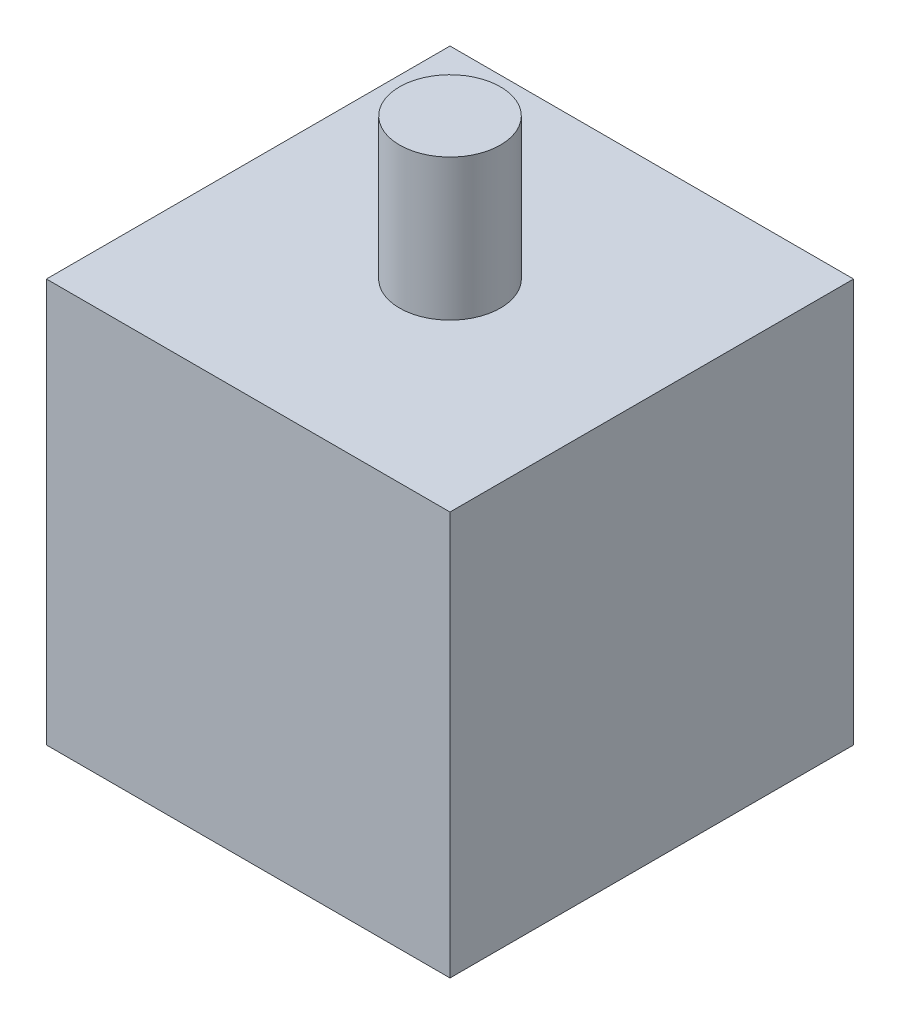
SolidWorks part; units mm, degrees
ref_plane "Front Plane" through (0, 0, 0) normal (0, 0, 1) x (1, 0, 0)
ref_plane "Top Plane" through (0, 0, 0) normal (0, 1, 0) x (1, 0, 0)
ref_plane "Right Plane" through (0, 0, 0) normal (1, 0, 0) x (0, 0, -1)
sketch "Sketch2" plane through (0, 0, 0) normal (0, 1, 0) x (1, 0, 0)
  line L1 (0, 0) -> (20, 0)
  line L2 (0, 0) -> (0, 20)
  line L3 (0, 20) -> (20, 20)
  line L4 (20, 0) -> (20, 20)
  dimension "D1" = 20
  dimension "D2" = 20
extrude "Boss-Extrude1" add sketch "Sketch2" along normal blind 20
sketch "Sketch3" plane through (0, 20, 0) normal (0, 1, 0) x (1, 0, 0)
  line L0 (0, 20) -> (0, 0) construction
  line L2 (20, 20) -> (0, 20) construction
  circle A0 centre (10, 10) radius 2.5
  dimension "D1" = 5
  dimension "D2" = 10
  dimension "D3" = 10
extrude "Boss-Extrude2" add sketch "Sketch3" along normal blind 7
